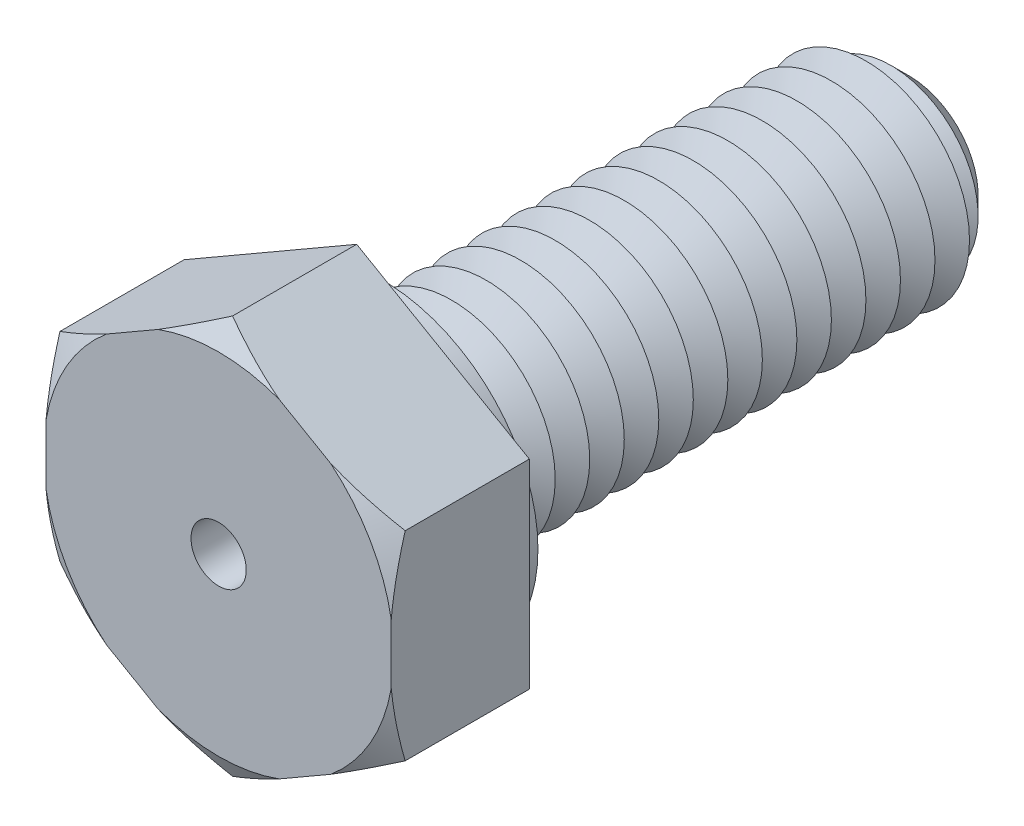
SolidWorks part; units mm, degrees
ref_plane "Front Plane" through (0, 0, 0) normal (0, 0, 1) x (1, 0, 0)
ref_plane "Top Plane" through (0, 0, 0) normal (0, 1, 0) x (1, 0, 0)
ref_plane "Right Plane" through (0, 0, 0) normal (1, 0, 0) x (0, 0, -1)
sketch "Sketch2" plane through (0, 0, 0) normal (0, 0, 1) x (1, 0, 0)
  line L1 (0, 5.7735) -> (-5, 2.8868)
  line L2 (-5, 2.8868) -> (-5, -2.8868)
  line L3 (-5, -2.8868) -> (0, -5.7735)
  line L4 (0, -5.7735) -> (5, -2.8868)
  line L5 (5, -2.8868) -> (5, 2.8868)
  line L6 (5, 2.8868) -> (0, 5.7735)
  circle A0 centre (0, 0) radius 5 construction
  dimension "D1" = 10
extrude "Boss-Extrude1" add sketch "Sketch2" along normal blind 4
sketch "Sketch3" plane through (0, 0, 0) normal (0, 0, -1) x (-1, 0, 0)
  circle A0 centre (0, 0) radius 3
  dimension "D1" = 6
extrude "Boss-Extrude2" add sketch "Sketch3" along normal blind 16
sketch "Sketch4" plane through (0, 0, 0) normal (0, 0, -1) x (-1, 0, 0)
  circle A0 centre (0, 0) radius 4.5
  dimension "D1" = 9
extrude "Boss-Extrude3" add sketch "Sketch4" along normal blind 0.75
sketch "Sketch5" plane through (0, 0, 0) normal (1, 0, 0) x (0, 0, -1)
  line L0 (-3.2117, 0) -> (6.3192, 0) construction
chamfer "Chamfer1" distance 1 angle 45 1 edges at (-3, 0, -16)
sketch "Sketch6" plane through (0, 0, 0) normal (1, 0, 0) x (0, 0, -1)
  line L0 (0.75, 3) -> (1.25, 2.134)
  line L1 (1.25, 2.134) -> (1.75, 3)
  line L2 (15, 3) -> (0.75, 3) construction
  line L3 (1.75, 3) -> (0.75, 3)
  dimension "D1" = 1
revolve "Cut-Revolve1" cut sketch "Sketch6" angle 360 about L0
pattern_linear "LPattern1" count 15 spacing 1 along (0, 0, -1) of "Cut-Revolve1"
sketch "Sketch7" plane through (0, 0, 0) normal (1, 0, 0) x (0, 0, -1)
  line L0 (-4, 5.7735) -> (-4, 5.0735)
  line L1 (-4, 2.8868) -> (-4, 5.7735) construction
  line L2 (-4, 5.0735) -> (-3.5959, 5.7735)
  line L3 (-4, 5.7735) -> (0, 5.7735) construction
  line L4 (-3.5959, 5.7735) -> (-4, 5.7735)
  dimension "D1" = 0.7
  dimension "D2" = 30
revolve "Cut-Revolve2" cut sketch "Sketch7" angle 360 about L0
sketch "Sketch8" plane through (0, 0, 4) normal (0, 0, 1) x (1, 0, 0)
  circle A0 centre (0, 0) radius 0.8
  dimension "D1" = 1.6
extrude "Cut-Extrude1" cut sketch "Sketch8" against normal up to surface (20 mm away)
